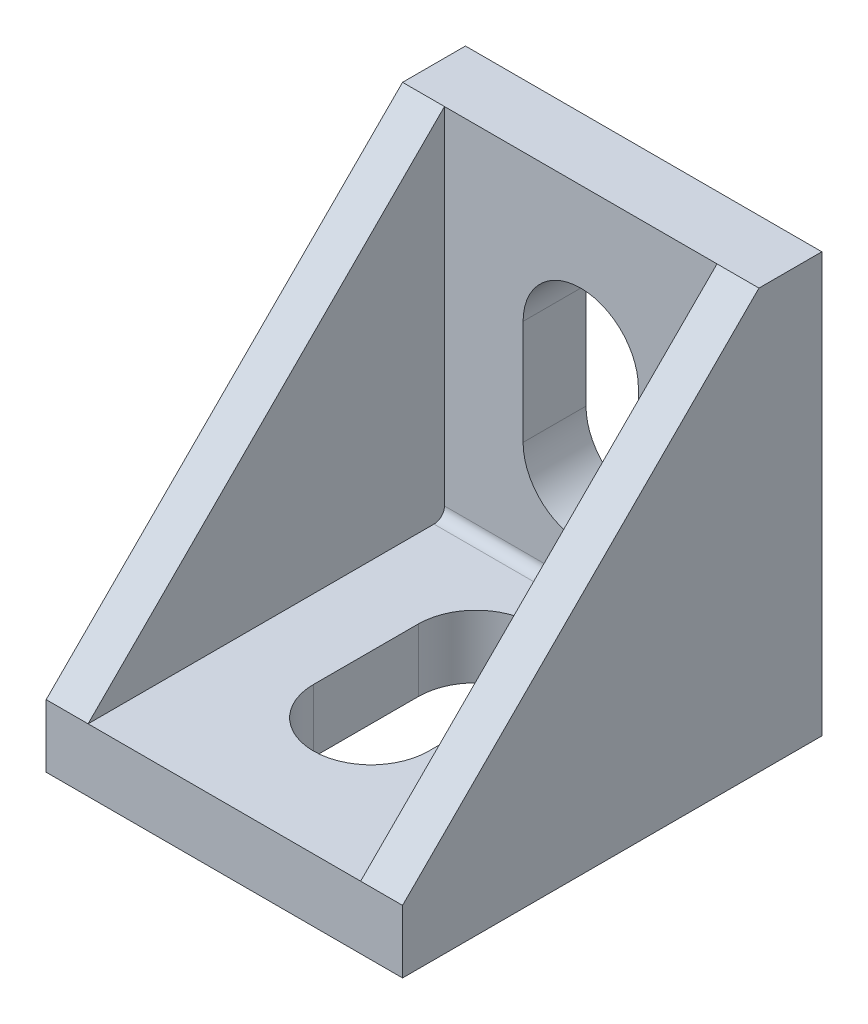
SolidWorks part; units mm, degrees
ref_plane "Front Plane" through (0, 0, 0) normal (0, 0, 1) x (1, 0, 0)
ref_plane "Top Plane" through (0, 0, 0) normal (0, 1, 0) x (1, 0, 0)
ref_plane "Right Plane" through (0, 0, 0) normal (1, 0, 0) x (0, 0, -1)
ref_plane "Plane1" through (8.5, 0, 0) normal (1, 0, 0) x (0, 0, -1)
sketch "Sketch16" plane through (8.5, 0, 0) normal (1, 0, 0) x (0, 0, -1)
  line L0 (-3, 3) -> (-3, 20)
  line L1 (-3, 20) -> (-20, 3)
  line L2 (-20, 3) -> (-3, 3)
  dimension "D1" = 17
  dimension "D2" = 17
extrude "Boss-Extrude1" add sketch "Sketch16" against normal blind 17
sketch "Sketch17" plane through (0, 0, 3) normal (0, 0, -1) x (-1, 0, 0)
  line L0 (-8.5, 3) -> (-8.5, 20)
  line L1 (-8.5, 20) -> (8.5, 20)
  line L2 (8.5, 20) -> (8.5, 3)
  line L3 (8.5, 3) -> (-8.5, 3)
  line L4 (-8.5, 3) -> (-8.5, 20) construction
  line L5 (8.5, 3) -> (-8.5, 3) construction
  dimension "D1" = 17
  dimension "D2" = 17
extrude "Boss-Extrude2" add sketch "Sketch17" along normal blind 3
ref_plane "Plane2" through (6.5, 0, 0) normal (1, 0, 0) x (0, 0, -1)
sketch "Sketch22" plane through (6.5, 0, 0) normal (1, 0, 0) x (0, 0, -1)
  line L0 (-3, 20) -> (-20, 3)
  line L1 (-20, 3) -> (-3, 3)
  line L2 (-3, 3) -> (-3, 20)
  dimension "D1" = 17
  dimension "D2" = 17
extrude "Cut-Extrude1" cut sketch "Sketch22" against normal blind 13
sketch "Sketch23" plane through (0, 3, 0) normal (0, -1, 0) x (1, 0, 0)
  line L0 (-8.5, 0) -> (-8.5, 20)
  line L1 (-8.5, 20) -> (8.5, 20)
  line L2 (8.5, 20) -> (8.5, 0)
  line L3 (8.5, 0) -> (-8.5, 0)
  line L4 (-8.5, 20) -> (-8.5, 0) construction
  dimension "D1" = 17
  dimension "D2" = 20
extrude "Boss-Extrude3" add sketch "Sketch23" along normal blind 3
sketch "Sketch24" plane through (0, 0, 0) normal (0, -1, 0) x (1, 0, 0)
  line L0 (6, 0) -> (6, 1)
  line L1 (6, 1) -> (-6, 1)
  line L2 (-6, 1) -> (-6, 0)
  line L3 (-6, 0) -> (6, 0)
  line L4 (8.5, 0) -> (8.5, 20) construction
  line L5 (-8.5, 0) -> (8.5, 0) construction
  dimension "D1" = 2.5
  dimension "D2" = 14.5
  dimension "D3" = 1
extrude "Cut-Extrude2" cut sketch "Sketch24" against normal blind 3
ref_plane "Plane3" through (0, 0, 3) normal (0, 0, 1) x (1, 0, 0)
sketch "Sketch30" plane through (0, 0, 3) normal (0, 0, 1) x (1, 0, 0)
  line L0 (-6, 1) -> (-6, 0)
  line L1 (-6, 0) -> (6, 0)
  line L2 (6, 0) -> (6, 1)
  line L3 (6, 1) -> (-6, 1)
  dimension "D1" = 12
  dimension "D2" = 1
ref_plane "Plane4" through (0, 0, 1) normal (0, 0, -1) x (-1, 0, 0)
extrude "Cut-Extrude3" cut sketch "Sketch30" against normal up to surface (2 mm away)
sketch "Sketch37" plane through (0, 0, 3) normal (0, 0, 1) x (1, 0, 0)
  line L0 (2.75, 8) -> (2.75, 13)
  line L1 (-2.75, 13) -> (-2.75, 8)
  line L2 (6.5, 3) -> (6.5, 20) construction
  line L3 (-6.5, 20) -> (6.5, 20) construction
  arc A0 (2.75, 13) -> (-2.75, 13) centre (0, 13) ccw
  arc A1 (-2.75, 8) -> (2.75, 8) centre (0, 8) ccw
  dimension "D1" = 2.75
  dimension "D2" = 6.5
  dimension "D3" = 7
  dimension "D4" = 12
extrude "Cut-Extrude4" cut sketch "Sketch37" against normal through all
sketch "Sketch38" plane through (0, 3, 0) normal (0, 1, 0) x (-1, 0, 0)
  line L0 (-2.75, 13) -> (-2.75, 8)
  line L1 (2.75, 8) -> (2.75, 13)
  line L2 (6.5, 20) -> (6.5, 3) construction
  arc A0 (2.75, 13) -> (-2.75, 13) centre (0, 13) ccw
  arc A1 (-2.75, 8) -> (2.75, 8) centre (0, 8) ccw
  dimension "D1" = 2.75
  dimension "D2" = 6.5
  dimension "D3" = 7
  dimension "D4" = 12
extrude "Cut-Extrude5" cut sketch "Sketch38" against normal through all
sketch "Sketch39" plane through (0, 0, 0) normal (0, -1, 0) x (1, 0, 0)
  line L0 (6, 19) -> (-6, 19)
  line L1 (-6, 19) -> (-6, 16)
  line L2 (-6, 16) -> (6, 16)
  line L3 (6, 16) -> (6, 19)
  line L4 (-6, 3) -> (-6, 0) construction
  line L5 (-6, 3) -> (6, 3) construction
  dimension "D1" = 12
  dimension "D2" = 13
  dimension "D3" = 16
extrude "Cut-Extrude6" cut sketch "Sketch39" against normal blind 1
sketch "Sketch40" plane through (0, 1, 0) normal (0, -1, 0) x (1, 0, 0)
  line L0 (-3, 18) -> (3, 18)
  line L1 (3, 18) -> (3, 17)
  line L2 (3, 17) -> (-3, 17)
  line L3 (-3, 17) -> (-3, 18)
  line L4 (6, 16) -> (6, 19) construction
  line L5 (6, 19) -> (-6, 19) construction
  dimension "D1" = 3
  dimension "D2" = 9
  dimension "D3" = 1
  dimension "D4" = 2
extrude "Boss-Extrude4" add sketch "Sketch40" along normal blind 2.5
sketch "Sketch41" plane through (0, 1, 0) normal (0, -1, 0) x (1, 0, 0)
  line L0 (-3, 1) -> (-3, 2)
  line L1 (-3, 2) -> (3, 2)
  line L2 (3, 2) -> (3, 1)
  line L3 (3, 1) -> (-3, 1)
  line L4 (6, 1) -> (6, 3) construction
  line L5 (6, 3) -> (-6, 3) construction
  dimension "D1" = 3
  dimension "D2" = 9
  dimension "D3" = 1
  dimension "D4" = 2
extrude "Boss-Extrude5" add sketch "Sketch41" along normal blind 2.5
ref_plane "Plane5" through (0, 0, -1.5) normal (0, 0, -1) x (-1, 0, 0)
sketch "Sketch49" plane through (0, 0, -1.5) normal (0, 0, -1) x (-1, 0, 0)
  line L0 (3, 1) -> (3, 2)
  line L1 (3, 2) -> (-3, 2)
  line L2 (-3, 2) -> (-3, 1)
  line L3 (-3, 1) -> (3, 1)
  dimension "D1" = 6
  dimension "D2" = 1
extrude "Boss-Extrude6" add sketch "Sketch49" against normal up to next
sketch "Sketch50" plane through (0, 0, 0) normal (0, 0, -1) x (-1, 0, 0)
  line L0 (-6, 16) -> (6, 16)
  line L1 (6, 16) -> (6, 19)
  line L2 (6, 19) -> (-6, 19)
  line L3 (-6, 19) -> (-6, 16)
  line L4 (6, 3) -> (6, 0) construction
  line L5 (6, 3) -> (-6, 3) construction
  dimension "D1" = 12
  dimension "D2" = 13
  dimension "D3" = 16
extrude "Cut-Extrude7" cut sketch "Sketch50" against normal blind 1
sketch "Sketch51" plane through (0, 0, 1) normal (0, 0, -1) x (-1, 0, 0)
  line L0 (3, 17) -> (-3, 17)
  line L1 (-3, 17) -> (-3, 18)
  line L2 (-3, 18) -> (3, 18)
  line L3 (3, 18) -> (3, 17)
  line L4 (-6, 19) -> (-6, 16) construction
  line L5 (-6, 16) -> (6, 16) construction
  dimension "D1" = 3
  dimension "D2" = 9
  dimension "D3" = 1
  dimension "D4" = 2
extrude "Boss-Extrude7" add sketch "Sketch51" along normal blind 2.5
fillet "Fillet1" radius 0.5 1 edges at (0, 3, 3)
